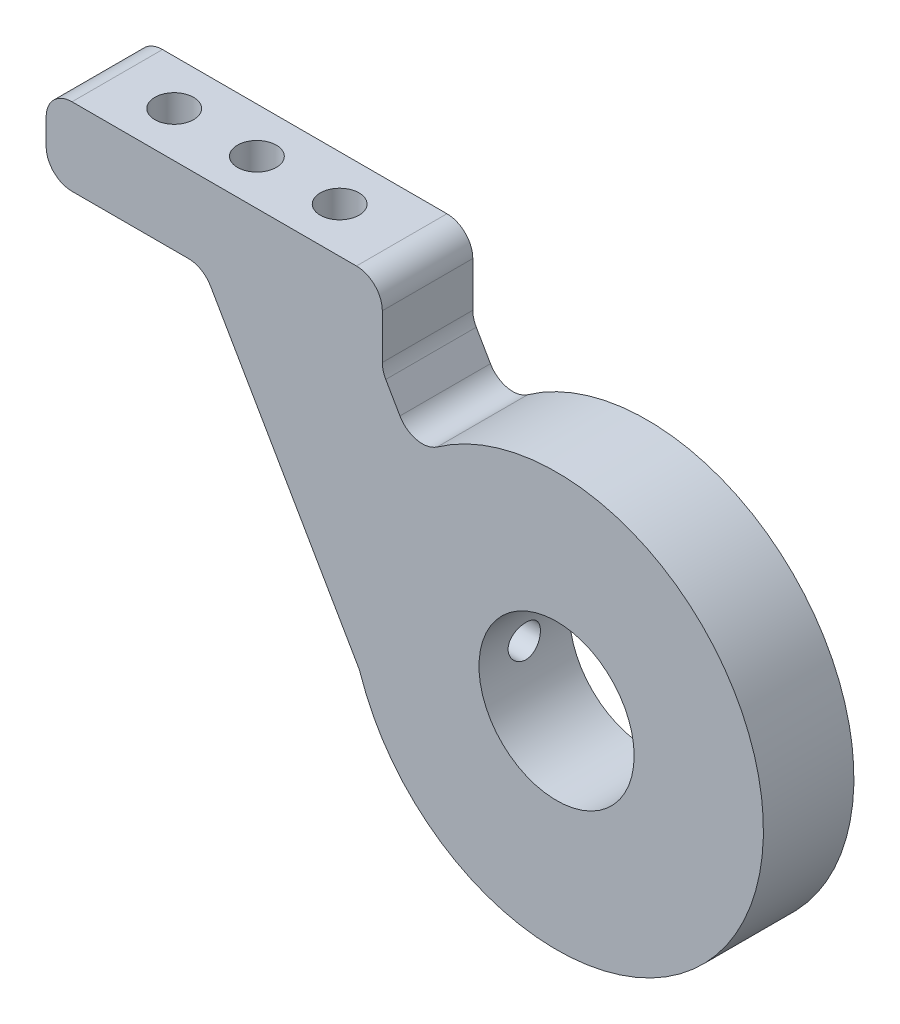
SolidWorks part; units mm, degrees
ref_plane "Front Plane" through (0, 0, 0) normal (0, 0, 1) x (1, 0, 0)
ref_plane "Top Plane" through (0, 0, 0) normal (0, 1, 0) x (1, 0, 0)
ref_plane "Right Plane" through (0, 0, 0) normal (1, 0, 0) x (0, 0, -1)
sketch "Sketch2" plane through (0, 0, 0) normal (0, 0, 1) x (1, 0, 0)
  circle A0 centre (0, 0) radius 50.8
  dimension "D1" = 101.6
extrude "Boss-Extrude1" add sketch "Sketch2" along normal blind 22.225
sketch "Sketch3" plane through (0, 0, 22.225) normal (0, 0, 1) x (1, 0, 0)
  line L3 (0, 0) -> (17.5, 0) construction
  circle A4 centre (0, 0) radius 19.05
  dimension "D1" = 38.1
extrude "Cut-Extrude1" cut sketch "Sketch3" against normal up to vertex (22.225 mm away)
sketch "Sketch19" plane through (0, 0, 22.225) normal (0, 0, 1) x (1, 0, 0)
  line L0 (-34.7409, 37.0636) -> (-53.7909, 70.0592)
  line L1 (-66.8023, 73.5456) -> (-83.3001, 64.0206)
  line L2 (-86.7864, 51.0092) -> (-48.3654, -15.5381)
  arc A0 (-53.7909, 70.0592) -> (-66.8023, 73.5456) centre (-62.0398, 65.2967) ccw
  arc A1 (-34.7409, 37.0636) -> (-48.3654, -15.5381) centre (0, 0) ccw
  arc A2 (-83.3001, 64.0206) -> (-86.7864, 51.0092) centre (-78.5376, 55.7717) ccw
  circle A3 centre (0, 0) radius 50.8 construction
  dimension "D1" = 38.1
  dimension "D2" = 38.1
extrude "Boss-Extrude2" add sketch "Sketch19" against normal blind 22.225
sketch "Sketch21" plane through (0, 0, 22.225) normal (0, 0, 1) x (1, 0, 0)
  line L0 (-86.7864, 51.0092) -> (15.9092, 51.0092)
  line L1 (15.9092, 51.0092) -> (15.9092, 107.4418)
  line L2 (15.9092, 107.4418) -> (-101.5493, 107.4418)
  line L3 (-86.7864, 51.0092) -> (-138.4532, 51.0092)
  line L4 (-138.4532, 51.0092) -> (-138.4532, 107.4418)
  line L5 (-138.4532, 107.4418) -> (-101.5493, 107.4418)
extrude "Cut-Extrude5" cut sketch "Sketch21" against normal through all
sketch "Sketch23" plane through (0, 51.0092, 0) normal (0, 1, 0) x (1, 0, 0)
  line L1 (-42.7924, -22.225) -> (-125.3424, -22.225)
  line L2 (-42.7924, -22.225) -> (-42.7924, 0)
  line L3 (-42.7924, 0) -> (-125.3424, 0)
  line L4 (-125.3424, -22.225) -> (-125.3424, 0)
  dimension "D1" = 82.55
extrude "Boss-Extrude3" add sketch "Sketch23" along normal blind 19.05
sketch "Sketch24" plane through (0, 70.0592, 0) normal (0, 1, 0) x (1, 0, 0)
  line L0 (-125.3424, 0) -> (-125.3424, -22.225) construction
  line L1 (-125.3424, 0) -> (-125.3424, -22.225) construction
  circle A0 centre (-105.0224, -11.1125) radius 4.7625
  circle A1 centre (-64.3824, -11.1125) radius 4.7625
  circle A2 centre (-84.7024, -11.1125) radius 4.7625
  point P4 (-125.3424, -11.1125)
  dimension "D1" = 9.525
  dimension "D2" = 9.525
  dimension "D5" = 9.525
  dimension "D3" = 40.64
  dimension "D4" = 20.32
  dimension "D6" = 40.64
extrude "Cut-Extrude6" cut sketch "Sketch24" against normal blind 12.7
sketch "Sketch25" plane through (0, 0, 0) normal (1, 0, 0) x (0, 0, -1)
  circle A0 centre (-11.1125, 0) radius 3.9688
  dimension "D2" = 7.9375
  dimension "D1" = 11.1125
extrude "Cut-Extrude7" cut sketch "Sketch25" against normal blind 171.704
sketch "Sketch26" plane through (-125.3424, 0, 0) normal (-1, 0, 0) x (0, 0, 1)
  circle A0 centre (11.1125, 0) radius 7.9375
  circle A1 centre (11.1125, 0) radius 3.9688 construction
  dimension "D1" = 15.875
extrude "Cut-Extrude8" cut sketch "Sketch26" against normal blind 79.756
fillet "Fillet1" radius 6.35 7 edges at (-48.3654, -15.5381, 11.1125) (-125.3424, 70.0592, 11.1125) (-125.3424, 51.0092, 11.1125) (-86.7864, 51.0092, 11.1125) (-34.7409, 37.0636, 11.1125) (-42.7924, 70.0592, 11.1125) (-42.7924, 51.0092, 11.1125)
